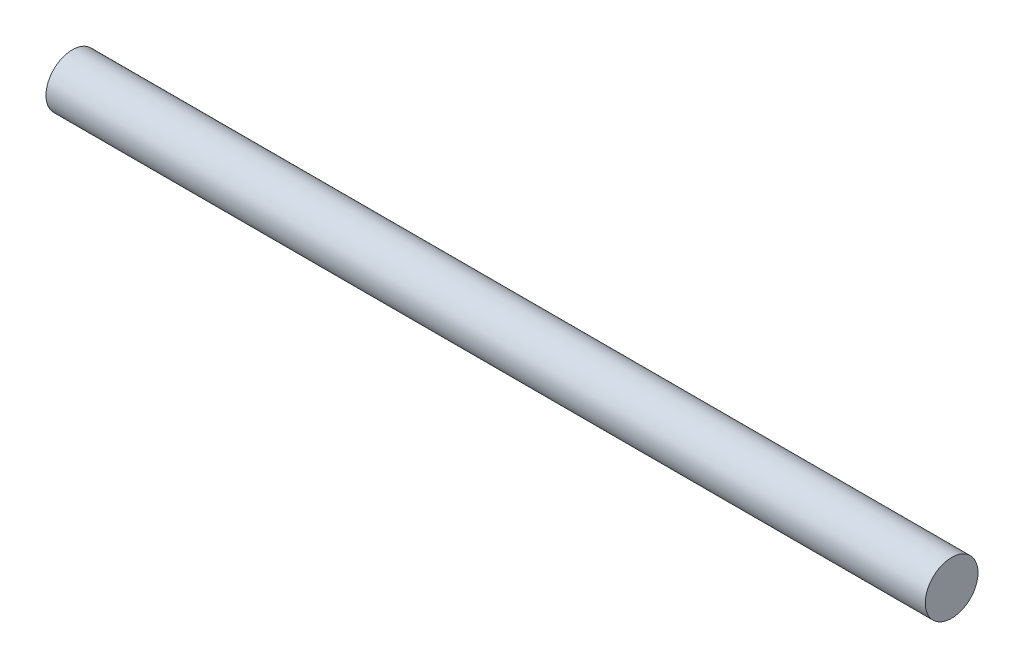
SolidWorks part; units mm, degrees
ref_plane "Front Plane" through (0, 0, 0) normal (0, 0, 1) x (1, 0, 0)
ref_plane "Top Plane" through (0, 0, 0) normal (0, 1, 0) x (1, 0, 0)
ref_plane "Right Plane" through (0, 0, 0) normal (1, 0, 0) x (0, 0, -1)
sketch "Sketch1" plane through (0, 0, 0) normal (1, 0, 0) x (0, 0, -1)
  circle A0 centre (10.8703, -21.8765) radius 0.9
  dimension "D1" = 1.8
extrude "Boss-Extrude1" add sketch "Sketch1" along normal blind 30
